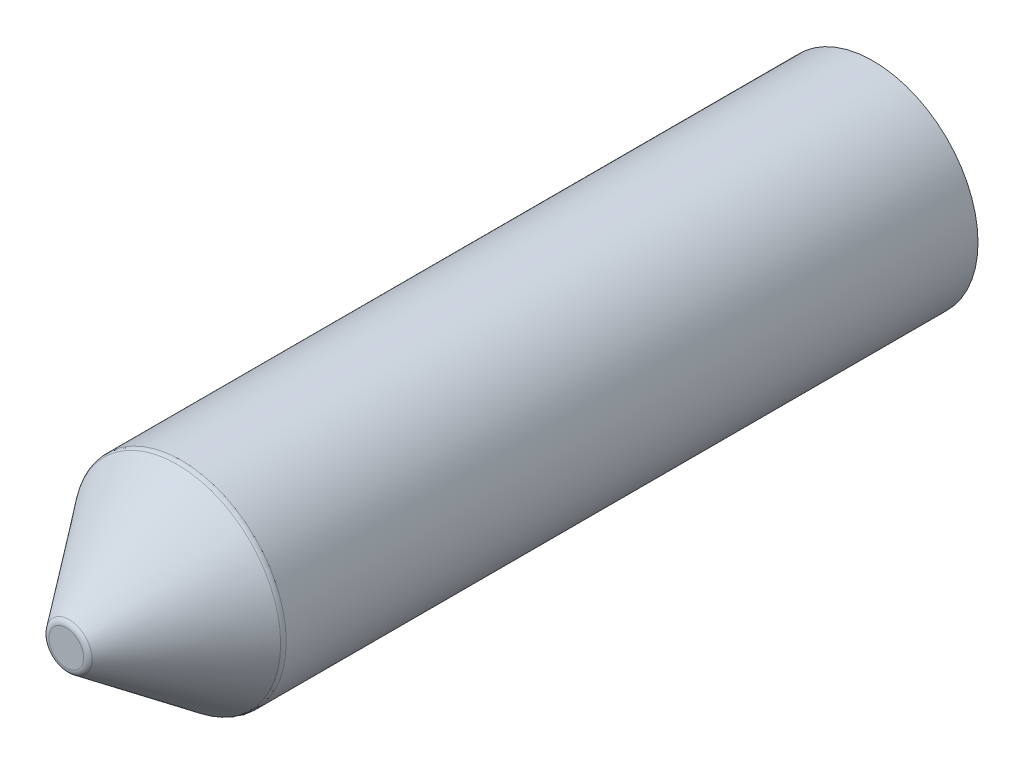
SolidWorks part; units mm, degrees
ref_plane "Front" through (0, 0, 0) normal (0, 0, 1) x (1, 0, 0)
ref_plane "Top" through (0, 0, 0) normal (0, 1, 0) x (1, 0, 0)
ref_plane "Right" through (0, 0, 0) normal (1, 0, 0) x (0, 0, -1)
sketch "Sketch1" plane through (0, 0, 0) normal (0, 0, 1) x (1, 0, 0)
  circle A0 centre (0, 0) radius 14.865
  dimension "D1" = 29.73
extrude "Extrude1" add sketch "Sketch1" along normal blind 114.45
chamfer "Chamfer2" distance 16 distance2 11.9
fillet "Fillet1" radius 1
shell "Shell1" thickness 1
